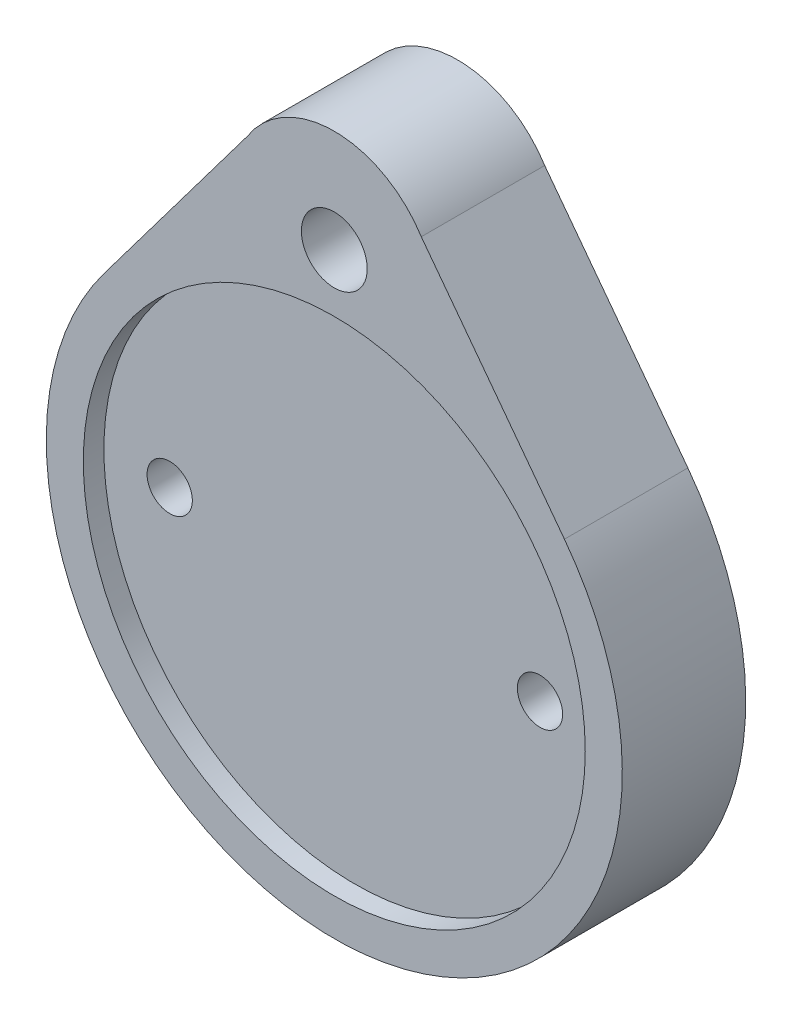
SolidWorks part; units mm, degrees
ref_plane "Plan de face" through (0, 0, 0) normal (0, 0, 1) x (1, 0, 0)
ref_plane "Plan de dessus" through (0, 0, 0) normal (0, 1, 0) x (1, 0, 0)
ref_plane "Plan de droite" through (0, 0, 0) normal (1, 0, 0) x (0, 0, -1)
sketch "Esquisse1" plane through (0, 0, 0) normal (0, 0, 1) x (1, 0, 0)
  line L0 (0, 0) -> (0, 15) construction
  line L1 (18.7189, 0) -> (-10.2863, 0) construction
  line L2 (18.7189, 15) -> (-10.2863, 15) construction
  line L3 (-4.2295, 17.6667) -> (-11.1881, 8.4158)
  line L4 (4.2295, 17.6667) -> (11.1881, 8.4158)
  arc A0 (-11.1881, 8.4158) -> (11.1881, 8.4158) centre (0, 0) ccw
  circle A1 centre (0, 15) radius 1.6
  arc A3 (4.2295, 17.6667) -> (-4.2295, 17.6667) centre (0, 15) ccw
  dimension "D1" = 15
extrude "Boss.-Extru.1" add sketch "Esquisse1" along normal blind 6
sketch "Esquisse2" plane through (0, 0, 6) normal (0, 0, 1) x (1, 0, 0)
  circle A0 centre (0, 0) radius 12.2
extrude "Enlèv. mat.-Extru.1" cut sketch "Esquisse2" against normal blind 1
sketch "Esquisse3" plane through (0, 0, 5) normal (0, 0, 1) x (1, 0, 0)
  line L0 (20.1545, 0) -> (-7.495, 0) construction
  line L1 (0, -2.0069) -> (0, 12.2) construction
  line L2 (9, -2.0069) -> (9, 6.9967) construction
  circle A0 centre (0, 0) radius 12.2 construction
  circle A1 centre (9, 0) radius 1.1
  circle A2 centre (-9, 0) radius 1.1
  dimension "D1" = 9
extrude "Enlèv. mat.-Extru.2" cut sketch "Esquisse3" against normal blind 2
